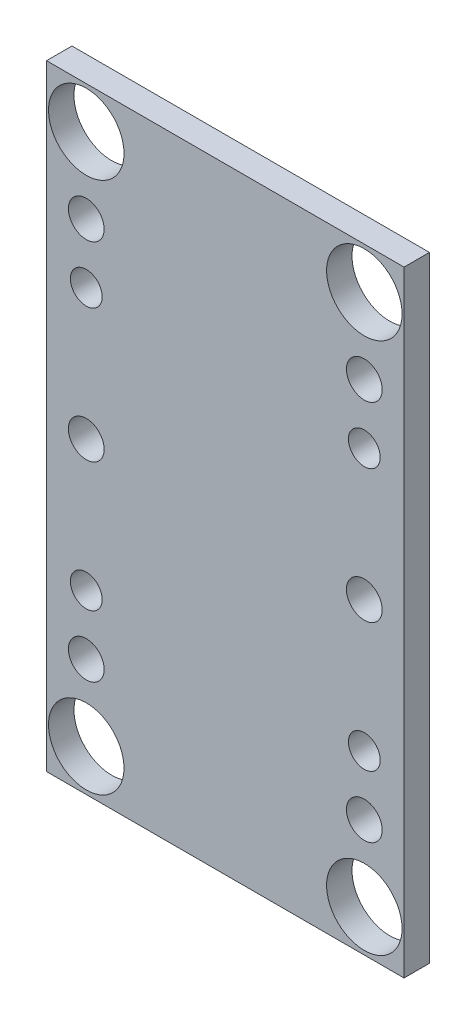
SolidWorks part; units mm, degrees
ref_plane "Plan de face" through (0, 0, 0) normal (0, 0, 1) x (1, 0, 0)
ref_plane "Plan de dessus" through (0, 0, 0) normal (0, 1, 0) x (1, 0, 0)
ref_plane "Plan de droite" through (0, 0, 0) normal (1, 0, 0) x (0, 0, -1)
sketch "Esquisse1" plane through (0, 0, 0) normal (0, 0, 1) x (1, 0, 0)
  line L0 (-45, -78) -> (45, -78)
  line L1 (45, -78) -> (45, 78)
  line L2 (45, 78) -> (-45, 78)
  line L3 (-45, 78) -> (-45, -78)
  line L4 (0, 89.9154) -> (0, -85.9531) construction
  line L5 (-35, 96.6348) -> (-35, -90.098) construction
  line L6 (35, 96.6348) -> (35, -90.098) construction
  circle A0 centre (35, 33) radius 4.0038
  circle A1 centre (35, -33) radius 4.0038
  circle A2 centre (35, 48) radius 4.5
  circle A3 centre (35, 0) radius 4.5
  circle A4 centre (35, -48) radius 4.5
  circle A5 centre (35, 67) radius 9.5
  circle A6 centre (35, -67) radius 9.5
  circle A7 centre (-35, -33) radius 4.0038
  circle A8 centre (-35, 33) radius 4.0038
  circle A9 centre (-35, -48) radius 4.5
  circle A10 centre (-35, 0) radius 4.5
  circle A11 centre (-35, 48) radius 4.5
  circle A12 centre (-35, -67) radius 9.5
  circle A13 centre (-35, 67) radius 9.5
  dimension "D2" = 8.0075
  dimension "D1" = 90
extrude "Extrusion1" add sketch "Esquisse1" along normal blind 6.4
sketch "Esquisse2" plane through (0, 0, 0) normal (0, 0, -1) x (-1, 0, 0)
  line L0 (96.3569, 0) -> (-71.9201, 0) construction
  line L1 (-45, -78) -> (-45, 78) construction
  line L2 (45, 78) -> (45, -78) construction
  line L3 (-45, -77.5) -> (-45, 77.5)
  line L4 (45, 77.5) -> (45, -77.5)
  line L5 (45, -77.5) -> (-45, -77.5)
  line L6 (45, 77.5) -> (-45, 77.5)
  circle A0 centre (35, -67) radius 9.5 construction
  circle A1 centre (35, 67) radius 9.5 construction
  dimension "D1" = 155
extrude "Enlèv. mat.-Extru.1" cut sketch "Esquisse2" against normal blind 10 flip side to cut
